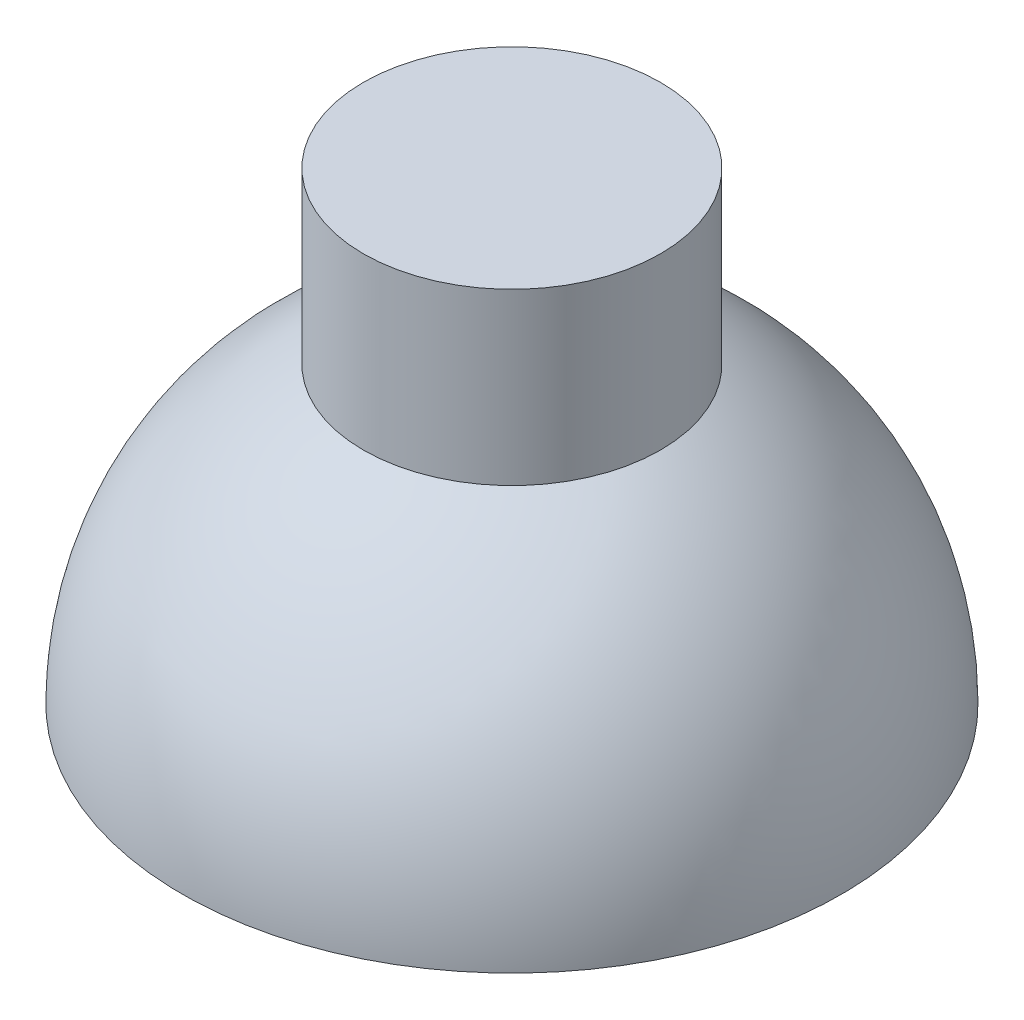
SolidWorks part; units mm, degrees
ref_plane "Face" through (0, 0, 0) normal (0, 0, 1) x (1, 0, 0)
ref_plane "Dessus" through (0, 0, 0) normal (0, 1, 0) x (1, 0, 0)
ref_plane "Droite" through (0, 0, 0) normal (1, 0, 0) x (0, 0, -1)
sketch "Esquisse1" plane through (0, 0, 0) normal (0, 0, 1) x (1, 0, 0)
  line L0 (0, 0) -> (17.75, 0)
  line L1 (0, 0) -> (0, 17.75)
  line L2 (0, -74.7415) -> (0, 93.5246) construction
  arc A0 (0, 17.75) -> (17.75, 0) centre (0, 0) cw
  dimension "D1" = 17.75
revolve "Révolution2" add sketch "Esquisse1" angle 360 about L2
sketch "Esquisse2" plane through (0, 0, 0) normal (0, 1, 0) x (1, 0, 0)
  circle A0 centre (0, 0) radius 8
  dimension "D1" = 16
extrude "Extrusion1" add sketch "Esquisse2" along normal blind 25
